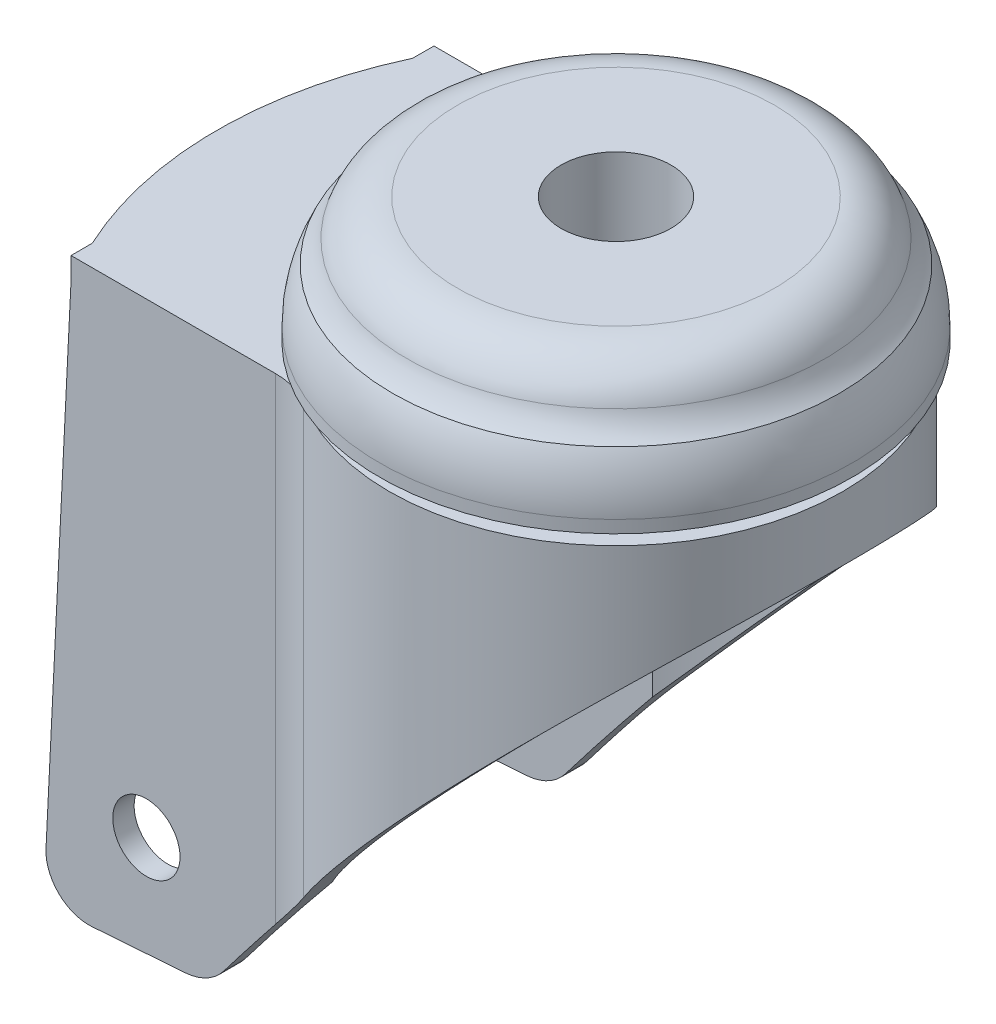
SolidWorks part; units mm, degrees
ref_plane "Plan de face" through (0, 0, 0) normal (0, 0, 1) x (1, 0, 0)
ref_plane "Plan de dessus" through (0, 0, 0) normal (0, 1, 0) x (1, 0, 0)
ref_plane "Plan de droite" through (0, 0, 0) normal (1, 0, 0) x (0, 0, -1)
imported_body "Importée3"
sketch "Esquisse1" plane through (0, -21.4306, 0) normal (0, -1, 0) x (1, 0, 0)
  line L0 (-11.6627, -15) -> (-11.5803, -15)
  line L1 (-11.5803, 15) -> (-11.6627, 15)
  arc A0 (-11.5803, -15) -> (-11.5803, 15) centre (0, 0) ccw
  spline S0 degree 3 poles (-11.6627, 15) (-20.6794, 7.9894) (-20.6816, -7.9877) (-11.6627, -15) knots 0 0 0 0 1 1 1 1
extrude "Enlèv. mat.-Extru.1" [suppressed] cut sketch "Esquisse1" against normal blind 5.1221
sketch "Esquisse2" plane through (0, -15.3, 0) normal (0, 1, 0) x (-1, 0, 0)
  line L0 (34.063, -15.005) -> (34.057, -17)
  line L1 (34.057, -17) -> (12.75, -17)
  line L2 (12.75, 17) -> (34.057, 17)
  line L3 (34.057, 17) -> (34.063, 15.005)
  arc A0 (34.063, 15.005) -> (34.063, -15.005) centre (1.89, 0) cw
  arc A1 (12.75, -17) -> (12.75, 17) centre (0, 0) cw
extrude "Boss.-Extru.1" add sketch "Esquisse2" along normal blind 2
sketch "Esquisse3" plane through (0, 0, 0) normal (0, 0, 1) x (1, 0, 0)
  line L0 (14.8628, 0) -> (0, 0)
  line L1 (0, 0) -> (0, -13.3)
  line L2 (0, -13.3) -> (19.0005, -13.3)
  line L3 (19.0005, -13.3) -> (19.0005, -12.3206)
  line L4 (18.9525, -11.7027) -> (22.1408, -11.7027)
  line L5 (22.1408, -11.7027) -> (22.1408, -10.5393)
  line L6 (0, 0.0013) -> (0, -13.3) construction
  arc A0 (19.0005, -12.3206) -> (18.9525, -11.7027) centre (15.0001, -12.3206) ccw
  arc A1 (22.1408, -10.5393) -> (20.9283, -5.4972) centre (11.051, -10.5393) ccw
  arc A2 (20.9283, -5.4972) -> (19.5556, -3.389) centre (24.2484, -1.8344) cw
  arc A3 (19.5556, -3.389) -> (14.8628, 0) centre (14.8628, -4.9436) ccw
revolve "Révolution1" add sketch "Esquisse3" angle 360 about L6
hole_wizard "Diamètre du perçage Ø6.3 (6.3)1" positions "Esquisse5" profile "Esquisse4" hole size "Ø6.3" standard "Ansi Metric"
sketch "Esquisse5" plane through (0, 0, 17) normal (0, 0, 1) x (1, 0, 0)
  point P0 (-27, -57)
sketch "Esquisse4" plane through (-27, -57, 17) normal (1, 0, 0) x (0, -1, 0)
  line L0 (0, 0) -> (0, 2)
  line L1 (0, 2) -> (3.15, 2)
  line L2 (3.15, 2) -> (3.15, 0)
  line L5 (3.15, 0) -> (0, 0)
  line L11 (0, -6.35) -> (0, 107.95) construction
  dimension "Diamètre du perçage jusqu'au prochain" = 6.3
  dimension "Profondeur du perçage jusqu'au prochain" = 2
hole_wizard "Diamètre du perçage Ø6.3 (6.3)2" positions "Esquisse7" profile "Esquisse6" hole size "Ø6.3" standard "Ansi Metric"
sketch "Esquisse7" plane through (0, 0, -17) normal (0, 0, -1) x (-1, 0, 0)
  point P0 (27, -57)
sketch "Esquisse6" plane through (-27, -57, -17) normal (1, 0, 0) x (0, 1, 0)
  line L0 (0, 0) -> (0, 39.1408)
  line L1 (0, 39.1408) -> (3.15, 39.1408)
  line L2 (3.15, 39.1408) -> (3.15, 0)
  line L5 (3.15, 0) -> (0, 0)
  line L11 (0, -6.35) -> (0, 107.95) construction
  dimension "Diamètre du perçage jusqu'au prochain" = 6.3
  dimension "Profondeur du perçage jusqu'au prochain" = 39.1408
hole_wizard "Perçage1" positions "Esquisse9" profile "Esquisse8" legacy
sketch "Esquisse9" plane through (0, 0, 0) normal (0, 1, 0) x (1, 0, 0)
  point P0 (0, 0)
sketch "Esquisse8" plane through (0, 0, 0) normal (1, 0, 0) x (0, 0, 1)
  line L0 (0, 0) -> (0, 21.4306)
  line L1 (0, 21.4306) -> (5.15, 21.4306)
  line L2 (5.15, 21.4306) -> (5.15, 0)
  line L3 (5.15, 0) -> (0, 0)
  line L4 (0, 110) -> (0, -10) construction
  dimension "Diamètre" = 10.3
  dimension "Profondeur" = 21.4306
fillet "Congé1" radius 4 2 edges at (-36.6299, -67.1018, -16) (-36.6299, -67.1018, 16)
fillet "Congé2" radius 5 2 edges at (-21.0967, -65.9923, 16) (-21.0967, -65.9923, -16)
fillet "Congé3" radius 7 3 edges at (-12.75, -34.3085, 17) (-12.75, -34.3085, -17) (21.211, -19.3424, -1.287)
